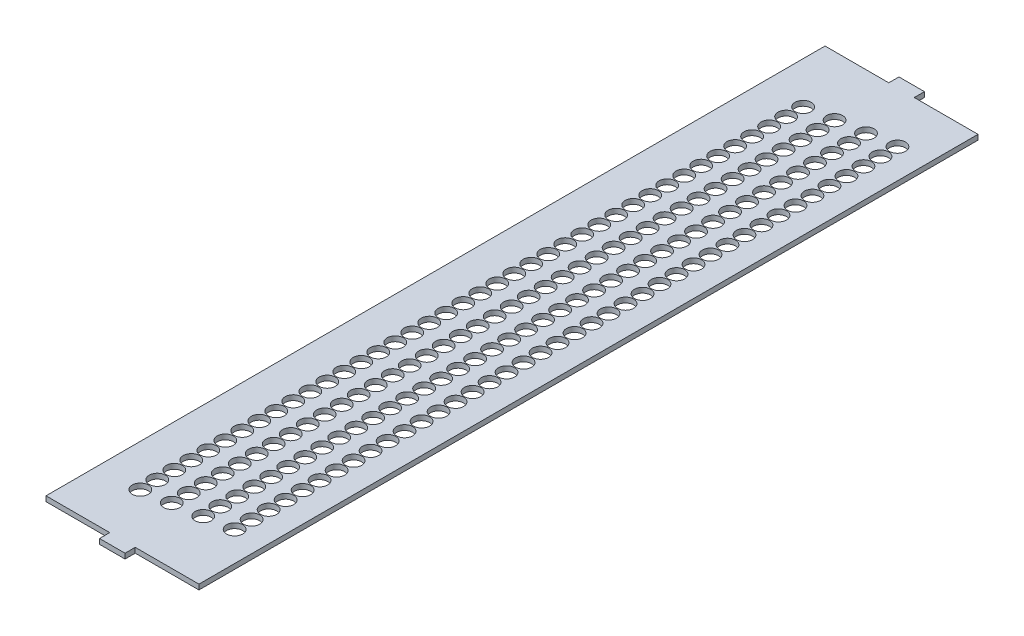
SolidWorks part; units mm, degrees
ref_plane "Alzado" through (0, 0, 0) normal (0, 0, 1) x (1, 0, 0)
ref_plane "Planta" through (0, 0, 0) normal (0, 1, 0) x (1, 0, 0)
ref_plane "Vista lateral" through (0, 0, 0) normal (1, 0, 0) x (0, 0, -1)
sketch "Croquis1" plane through (0, 0, 0) normal (0, 1, 0) x (1, 0, 0)
  line L0 (0, 458.4) -> (37.5, 458.4) construction
  line L1 (0, 0) -> (37.5, 0)
  line L2 (0, 0) -> (0, 458.4)
  line L3 (0, 458.4) -> (37.5, 458.4)
  line L4 (90, 0) -> (90, 458.4)
  line L5 (52.5, 458.4) -> (90, 458.4)
  line L6 (0, 229.2) -> (90, 229.2) construction
  line L7 (37.5, 458.4) -> (37.5, 464.4)
  line L8 (37.5, 464.4) -> (52.5, 464.4)
  line L9 (52.5, 458.4) -> (52.5, 464.4)
  line L10 (52.5, 0) -> (52.5, -6)
  line L11 (37.5, 0) -> (37.5, -6)
  line L12 (37.5, -6) -> (52.5, -6)
  line L13 (52.5, 0) -> (90, 0)
  circle A0 centre (24.6, 420.9) radius 4.75
  circle A1 centre (40.6, 423.4) radius 4.75
  circle A2 centre (56.6, 425.9) radius 4.75
  circle A3 centre (72.6, 428.4) radius 4.75
  circle A4 centre (24.6, 410.9) radius 4.75
  circle A5 centre (40.6, 413.4) radius 4.75
  circle A6 centre (56.6, 415.9) radius 4.75
  circle A7 centre (72.6, 418.4) radius 4.75
  circle A8 centre (24.6, 400.9) radius 4.75
  circle A9 centre (40.6, 403.4) radius 4.75
  circle A10 centre (56.6, 405.9) radius 4.75
  circle A11 centre (72.6, 408.4) radius 4.75
  circle A12 centre (24.6, 390.9) radius 4.75
  circle A13 centre (40.6, 393.4) radius 4.75
  circle A14 centre (56.6, 395.9) radius 4.75
  circle A15 centre (72.6, 398.4) radius 4.75
  circle A16 centre (24.6, 380.9) radius 4.75
  circle A17 centre (40.6, 383.4) radius 4.75
  circle A18 centre (56.6, 385.9) radius 4.75
  circle A19 centre (72.6, 388.4) radius 4.75
  circle A20 centre (24.6, 370.9) radius 4.75
  circle A21 centre (40.6, 373.4) radius 4.75
  circle A22 centre (56.6, 375.9) radius 4.75
  circle A23 centre (72.6, 378.4) radius 4.75
  circle A24 centre (24.6, 360.9) radius 4.75
  circle A25 centre (40.6, 363.4) radius 4.75
  circle A26 centre (56.6, 365.9) radius 4.75
  circle A27 centre (72.6, 368.4) radius 4.75
  circle A28 centre (24.6, 350.9) radius 4.75
  circle A29 centre (40.6, 353.4) radius 4.75
  circle A30 centre (56.6, 355.9) radius 4.75
  circle A31 centre (72.6, 358.4) radius 4.75
  circle A32 centre (24.6, 340.9) radius 4.75
  circle A33 centre (40.6, 343.4) radius 4.75
  circle A34 centre (56.6, 345.9) radius 4.75
  circle A35 centre (72.6, 348.4) radius 4.75
  circle A36 centre (24.6, 330.9) radius 4.75
  circle A37 centre (40.6, 333.4) radius 4.75
  circle A38 centre (56.6, 335.9) radius 4.75
  circle A39 centre (72.6, 338.4) radius 4.75
  circle A40 centre (24.6, 320.9) radius 4.75
  circle A41 centre (40.6, 323.4) radius 4.75
  circle A42 centre (56.6, 325.9) radius 4.75
  circle A43 centre (72.6, 328.4) radius 4.75
  circle A44 centre (24.6, 310.9) radius 4.75
  circle A45 centre (40.6, 313.4) radius 4.75
  circle A46 centre (56.6, 315.9) radius 4.75
  circle A47 centre (72.6, 318.4) radius 4.75
  circle A48 centre (24.6, 300.9) radius 4.75
  circle A49 centre (40.6, 303.4) radius 4.75
  circle A50 centre (56.6, 305.9) radius 4.75
  circle A51 centre (72.6, 308.4) radius 4.75
  circle A52 centre (24.6, 290.9) radius 4.75
  circle A53 centre (40.6, 293.4) radius 4.75
  circle A54 centre (56.6, 295.9) radius 4.75
  circle A55 centre (72.6, 298.4) radius 4.75
  circle A56 centre (24.6, 280.9) radius 4.75
  circle A57 centre (40.6, 283.4) radius 4.75
  circle A58 centre (56.6, 285.9) radius 4.75
  circle A59 centre (72.6, 288.4) radius 4.75
  circle A60 centre (24.6, 270.9) radius 4.75
  circle A61 centre (40.6, 273.4) radius 4.75
  circle A62 centre (56.6, 275.9) radius 4.75
  circle A63 centre (72.6, 278.4) radius 4.75
  circle A64 centre (24.6, 260.9) radius 4.75
  circle A65 centre (40.6, 263.4) radius 4.75
  circle A66 centre (56.6, 265.9) radius 4.75
  circle A67 centre (72.6, 268.4) radius 4.75
  circle A68 centre (24.6, 250.9) radius 4.75
  circle A69 centre (40.6, 253.4) radius 4.75
  circle A70 centre (56.6, 255.9) radius 4.75
  circle A71 centre (72.6, 258.4) radius 4.75
  circle A72 centre (24.6, 240.9) radius 4.75
  circle A73 centre (40.6, 243.4) radius 4.75
  circle A74 centre (56.6, 245.9) radius 4.75
  circle A75 centre (72.6, 248.4) radius 4.75
  circle A76 centre (24.6, 230.9) radius 4.75
  circle A77 centre (40.6, 233.4) radius 4.75
  circle A78 centre (56.6, 235.9) radius 4.75
  circle A79 centre (72.6, 238.4) radius 4.75
  circle A80 centre (24.6, 220.9) radius 4.75
  circle A81 centre (40.6, 223.4) radius 4.75
  circle A82 centre (56.6, 225.9) radius 4.75
  circle A83 centre (72.6, 228.4) radius 4.75
  circle A84 centre (24.6, 210.9) radius 4.75
  circle A85 centre (40.6, 213.4) radius 4.75
  circle A86 centre (56.6, 215.9) radius 4.75
  circle A87 centre (72.6, 218.4) radius 4.75
  circle A88 centre (24.6, 200.9) radius 4.75
  circle A89 centre (40.6, 203.4) radius 4.75
  circle A90 centre (56.6, 205.9) radius 4.75
  circle A91 centre (72.6, 208.4) radius 4.75
  circle A92 centre (24.6, 190.9) radius 4.75
  circle A93 centre (40.6, 193.4) radius 4.75
  circle A94 centre (56.6, 195.9) radius 4.75
  circle A95 centre (72.6, 198.4) radius 4.75
  circle A96 centre (24.6, 180.9) radius 4.75
  circle A97 centre (40.6, 183.4) radius 4.75
  circle A98 centre (56.6, 185.9) radius 4.75
  circle A99 centre (72.6, 188.4) radius 4.75
  circle A100 centre (24.6, 170.9) radius 4.75
  circle A101 centre (40.6, 173.4) radius 4.75
  circle A102 centre (56.6, 175.9) radius 4.75
  circle A103 centre (72.6, 178.4) radius 4.75
  circle A104 centre (24.6, 160.9) radius 4.75
  circle A105 centre (40.6, 163.4) radius 4.75
  circle A106 centre (56.6, 165.9) radius 4.75
  circle A107 centre (72.6, 168.4) radius 4.75
  circle A108 centre (24.6, 150.9) radius 4.75
  circle A109 centre (40.6, 153.4) radius 4.75
  circle A110 centre (56.6, 155.9) radius 4.75
  circle A111 centre (72.6, 158.4) radius 4.75
  circle A112 centre (24.6, 140.9) radius 4.75
  circle A113 centre (40.6, 143.4) radius 4.75
  circle A114 centre (56.6, 145.9) radius 4.75
  circle A115 centre (72.6, 148.4) radius 4.75
  circle A116 centre (24.6, 130.9) radius 4.75
  circle A117 centre (40.6, 133.4) radius 4.75
  circle A118 centre (56.6, 135.9) radius 4.75
  circle A119 centre (72.6, 138.4) radius 4.75
  circle A120 centre (24.6, 120.9) radius 4.75
  circle A121 centre (40.6, 123.4) radius 4.75
  circle A122 centre (56.6, 125.9) radius 4.75
  circle A123 centre (72.6, 128.4) radius 4.75
  circle A124 centre (24.6, 110.9) radius 4.75
  circle A125 centre (40.6, 113.4) radius 4.75
  circle A126 centre (56.6, 115.9) radius 4.75
  circle A127 centre (72.6, 118.4) radius 4.75
  circle A128 centre (24.6, 100.9) radius 4.75
  circle A129 centre (40.6, 103.4) radius 4.75
  circle A130 centre (56.6, 105.9) radius 4.75
  circle A131 centre (72.6, 108.4) radius 4.75
  circle A132 centre (24.6, 90.9) radius 4.75
  circle A133 centre (40.6, 93.4) radius 4.75
  circle A134 centre (56.6, 95.9) radius 4.75
  circle A135 centre (72.6, 98.4) radius 4.75
  circle A136 centre (24.6, 80.9) radius 4.75
  circle A137 centre (40.6, 83.4) radius 4.75
  circle A138 centre (56.6, 85.9) radius 4.75
  circle A139 centre (72.6, 88.4) radius 4.75
  circle A140 centre (24.6, 70.9) radius 4.75
  circle A141 centre (40.6, 73.4) radius 4.75
  circle A142 centre (56.6, 75.9) radius 4.75
  circle A143 centre (72.6, 78.4) radius 4.75
  circle A144 centre (24.6, 60.9) radius 4.75
  circle A145 centre (40.6, 63.4) radius 4.75
  circle A146 centre (56.6, 65.9) radius 4.75
  circle A147 centre (72.6, 68.4) radius 4.75
  circle A148 centre (24.6, 50.9) radius 4.75
  circle A149 centre (40.6, 53.4) radius 4.75
  circle A150 centre (56.6, 55.9) radius 4.75
  circle A151 centre (72.6, 58.4) radius 4.75
  circle A152 centre (24.6, 40.9) radius 4.75
  circle A153 centre (40.6, 43.4) radius 4.75
  circle A154 centre (56.6, 45.9) radius 4.75
  circle A155 centre (72.6, 48.4) radius 4.75
  circle A156 centre (24.6, 30.9) radius 4.75
  circle A157 centre (40.6, 33.4) radius 4.75
  circle A158 centre (56.6, 35.9) radius 4.75
  circle A159 centre (72.6, 38.4) radius 4.75
  dimension "D6" = 9.5
  dimension "D9" = 9.5
  dimension "D12" = 9.5
  dimension "D15" = 9.5
  dimension "D19" = 24.6
  dimension "D20" = 127.5
  dimension "D1" = 458.4
  dimension "D2" = 90
  dimension "D3" = 37.5
  dimension "D4" = 6
  dimension "D5" = 15
  dimension "D7" = 24.6
  dimension "D8" = 37.5
  dimension "D10" = 2.5
  dimension "D11" = 16
  dimension "D13" = 16
  dimension "D14" = 2.5
  dimension "D16" = 2.5
  dimension "D17" = 16
  dimension "D18" = 40
extrude "Saliente-Extruir1" add sketch "Croquis1" along normal blind 3
